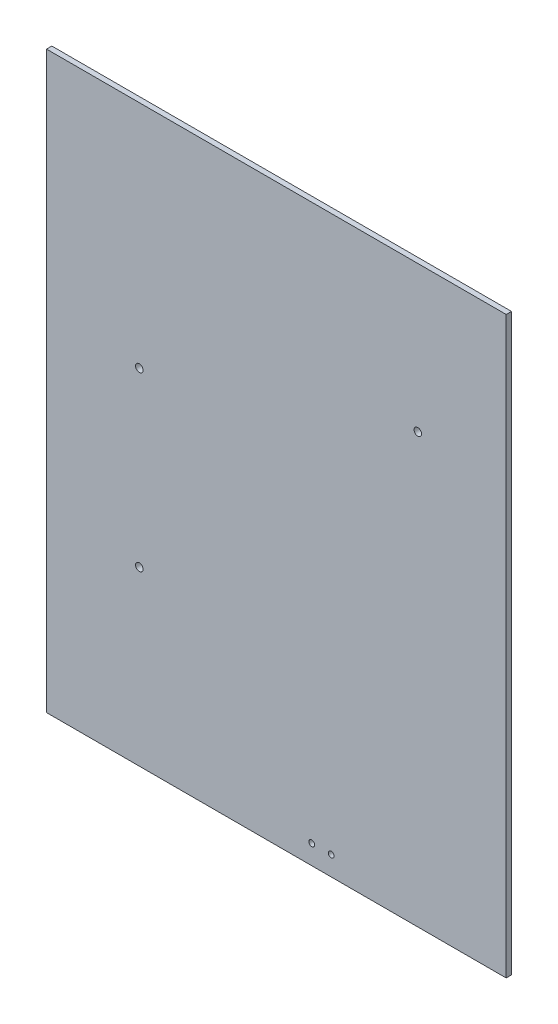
SolidWorks part; units mm, degrees
ref_plane "Plan1" through (0, 0, 0) normal (0, 0, 1) x (1, 0, 0)
ref_plane "Plan2" through (0, 0, 0) normal (0, 1, 0) x (1, 0, 0)
ref_plane "Plan3" through (0, 0, 0) normal (1, 0, 0) x (0, 0, -1)
sketch "Esquisse1" plane through (0, 0, 0) normal (0, 0, 1) x (1, 0, 0)
  line L1 (0, 0) -> (520, 0)
  line L2 (0, 0) -> (0, 650)
  line L3 (0, 650) -> (520, 650)
  line L4 (520, 0) -> (520, 650)
  dimension "D1" = 520
  dimension "D2" = 650
extrude "Base-Extrusion" add sketch "Esquisse1" along normal blind 6
sketch "Esquisse2" plane through (0, 0, 6) normal (0, 0, 1) x (1, 0, 0)
  line L0 (0, 0) -> (520, 0) construction
  line L1 (0, 650) -> (0, 0) construction
  circle A0 centre (420, 485) radius 4.25
  circle A1 centre (105, 390) radius 4.25
  circle A2 centre (105, 195) radius 4.25
  dimension "D1" = 8.5
  dimension "D2" = 8.5
  dimension "D3" = 8.5
  dimension "D4" = 195
  dimension "D5" = 105
  dimension "D6" = 195
  dimension "D7" = 315
  dimension "D8" = 95
extrude "Enlèv. mat.-Extru.1" cut sketch "Esquisse2" against normal up to next
sketch "Esquisse3" plane through (0, 0, 6) normal (0, 0, 1) x (1, 0, 0)
  line L0 (0, 650) -> (0, 0) construction
  line L1 (0, 0) -> (520, 0) construction
  circle A0 centre (300, 22) radius 3.25
  circle A1 centre (322, 22) radius 3.25
  dimension "D1" = 6.5
  dimension "D2" = 6.5
  dimension "D3" = 22
  dimension "D4" = 300
  dimension "D5" = 22
extrude "Enlèv. mat.-Extru.2" cut sketch "Esquisse3" against normal up to next
